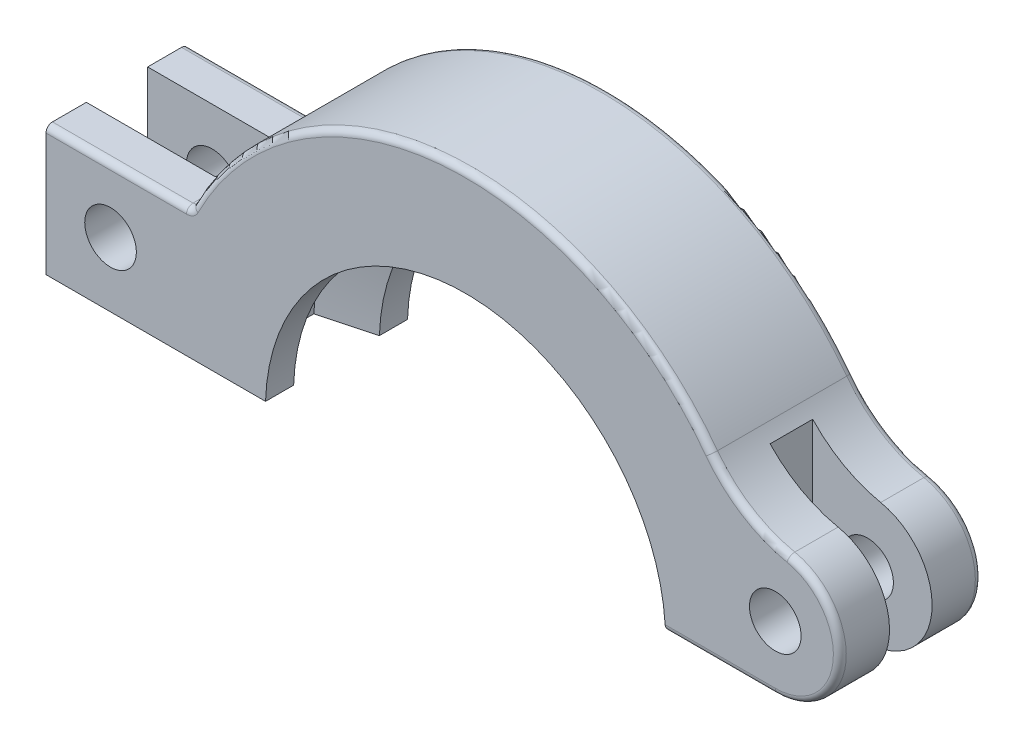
SolidWorks part; units mm, degrees
ref_plane "Plan de face" through (0, 0, 0) normal (0, 0, 1) x (1, 0, 0)
ref_plane "Plan de dessus" through (0, 0, 0) normal (0, 1, 0) x (1, 0, 0)
ref_plane "Plan de droite" through (0, 0, 0) normal (1, 0, 0) x (0, 0, -1)
sketch "Esquisse1" plane through (0, 0, 0) normal (0, 0, 1) x (1, 0, 0)
  line L0 (30.9839, 1) -> (48, 1)
  line L1 (-65, 1) -> (-30.9839, 1)
  line L2 (-65, 1) -> (-65, 21)
  line L3 (-65, 21) -> (-42.6058, 21)
  arc A0 (30.9839, 1) -> (-30.9839, 1) centre (0, 0) ccw
  arc A1 (38.066, 28.4117) -> (-42.6058, 21) centre (0, 0) ccw
  circle A2 centre (-55, 11) radius 4
  circle A3 centre (48, 11) radius 4
  arc A4 (48, 1) -> (50.0313, 20.7915) centre (48, 11) ccw
  arc A5 (38.066, 28.4117) -> (50.0313, 20.7915) centre (54.0938, 40.3746) ccw
  dimension "D1" = 31
  dimension "D3" = 47.5
  dimension "D6" = 10
  dimension "D8" = 8
  dimension "D9" = 8
  dimension "D11" = 10
  dimension "D12" = 40
  dimension "D2" = 1
  dimension "D4" = 65
  dimension "D5" = 20
  dimension "D7" = 55
  dimension "D10" = 48
extrude "Boss.-Extru.1" add sketch "Esquisse1" along normal mid plane 22
sketch "Esquisse2" plane through (0, 0, 0) normal (0, 1, 0) x (1, 0, 0)
  line L1 (-80.8633, 4.75) -> (-45, 4.75)
  line L2 (-80.8633, 4.75) -> (-80.8633, -4.75)
  line L3 (-80.8633, -4.75) -> (-45, -4.75)
  line L4 (-45, 4.75) -> (-45, -4.75)
  line L5 (69.3232, 3.3) -> (39.5, 3.3)
  line L6 (69.3232, 3.3) -> (69.3232, -3.3)
  line L7 (69.3232, -3.3) -> (39.5, -3.3)
  line L8 (39.5, 3.3) -> (39.5, -3.3)
  dimension "D1" = 6.6
  dimension "D2" = 9.5
  dimension "D3" = 3.3
  dimension "D4" = 4.75
  dimension "D5" = 45
  dimension "D6" = 39.5
extrude "Enlèv. mat.-Extru.2" cut sketch "Esquisse2" along normal through all
fillet "Congé1" radius 1 11 edges at (39.4919, 1, -11) (57.9477, 9.979, -11) (43.3504, 23.5051, -11) (39.4919, 1, 11) (57.9477, 9.979, 11) (43.3504, 23.5051, 11) (-53.8029, 21, -11) (-42.6058, 21, 0) (-53.8029, 21, 11) (-4.3458, 47.3008, -11) (-4.3458, 47.3008, 11)
sketch "Esquisse3" plane through (0, 0, 0) normal (0, 1, 0) x (1, 0, 0)
  line L0 (0, 0) -> (0, 29.5106) construction
  line L1 (-39, -4.5) -> (-39, 4.5)
  line L2 (-39, 4.5) -> (-26.5085, 7.8471)
  line L3 (-26.5085, 7.8471) -> (-26.5085, -7.8471)
  line L4 (-26.5085, -7.8471) -> (-39, -4.5)
  line L5 (0, 0) -> (33.5472, 0) construction
  dimension "D1" = 9
  dimension "D2" = 4.5
  dimension "D3" = 39
  dimension "D4" = 30
  dimension "D5" = 15
revolve "Enlèvement de matière-Révolution1" cut sketch "Esquisse3" angle 360 about L0
